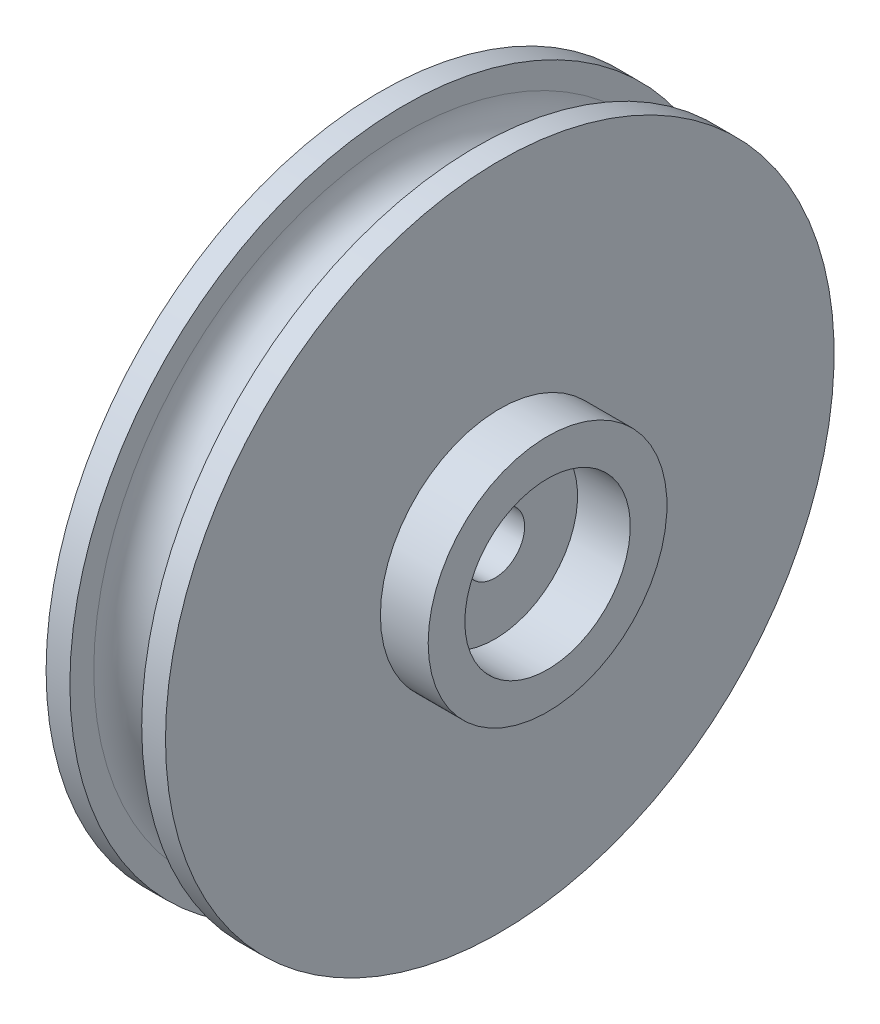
SolidWorks part; units mm, degrees
ref_plane "Front Plane" through (0, 0, 0) normal (0, 0, 1) x (1, 0, 0)
ref_plane "Top Plane" through (0, 0, 0) normal (0, 1, 0) x (1, 0, 0)
ref_plane "Right Plane" through (0, 0, 0) normal (1, 0, 0) x (0, 0, -1)
sketch "Sketch1" plane through (0, 0, 0) normal (0, 0, 1) x (1, 0, 0)
  line L0 (0, 0) -> (12.7127, 0) construction
  line L1 (7.9375, 15.875) -> (7.9375, 44.45)
  line L2 (7.9375, 44.45) -> (4.7752, 44.45)
  line L3 (-7.9375, 44.45) -> (-7.9375, 15.875)
  line L4 (-12.7127, 0) -> (0, 0) construction
  line L5 (0, 0) -> (0, 14.7172) construction
  line L6 (4.7752, 44.45) -> (4.7752, 41.275)
  line L7 (-4.7752, 41.275) -> (-4.7752, 44.45)
  line L8 (-4.7752, 44.45) -> (-7.9375, 44.45)
  line L9 (-7.9375, 15.875) -> (-14.2875, 15.875)
  line L10 (-14.2875, 15.875) -> (-14.2875, 11)
  line L11 (7.9375, 15.875) -> (14.2875, 15.875)
  line L12 (14.2875, 15.875) -> (14.2875, 11)
  line L13 (-14.2875, 11) -> (-7.2771, 11)
  line L14 (-7.2771, 11) -> (-7.2771, 3.9624)
  line L15 (-7.2771, 3.9624) -> (7.2771, 3.9624)
  line L16 (7.2771, 3.9624) -> (7.2771, 11)
  line L17 (7.2771, 11) -> (14.2875, 11)
  arc A0 (4.7752, 41.275) -> (-4.7752, 41.275) centre (0, 41.275) cw
  dimension "D1" = 4.7752
  dimension "D10" = 72.9996
  dimension "D2" = 15.875
  dimension "D3" = 3.175
  dimension "D4" = 6.35
  dimension "D5" = 31.75
  dimension "D6" = 88.9
  dimension "D7" = 7.9248
  dimension "D8" = 22
  dimension "D9" = 7.0104
revolve "Revolve2" add sketch "Sketch1" angle 360 about L0
